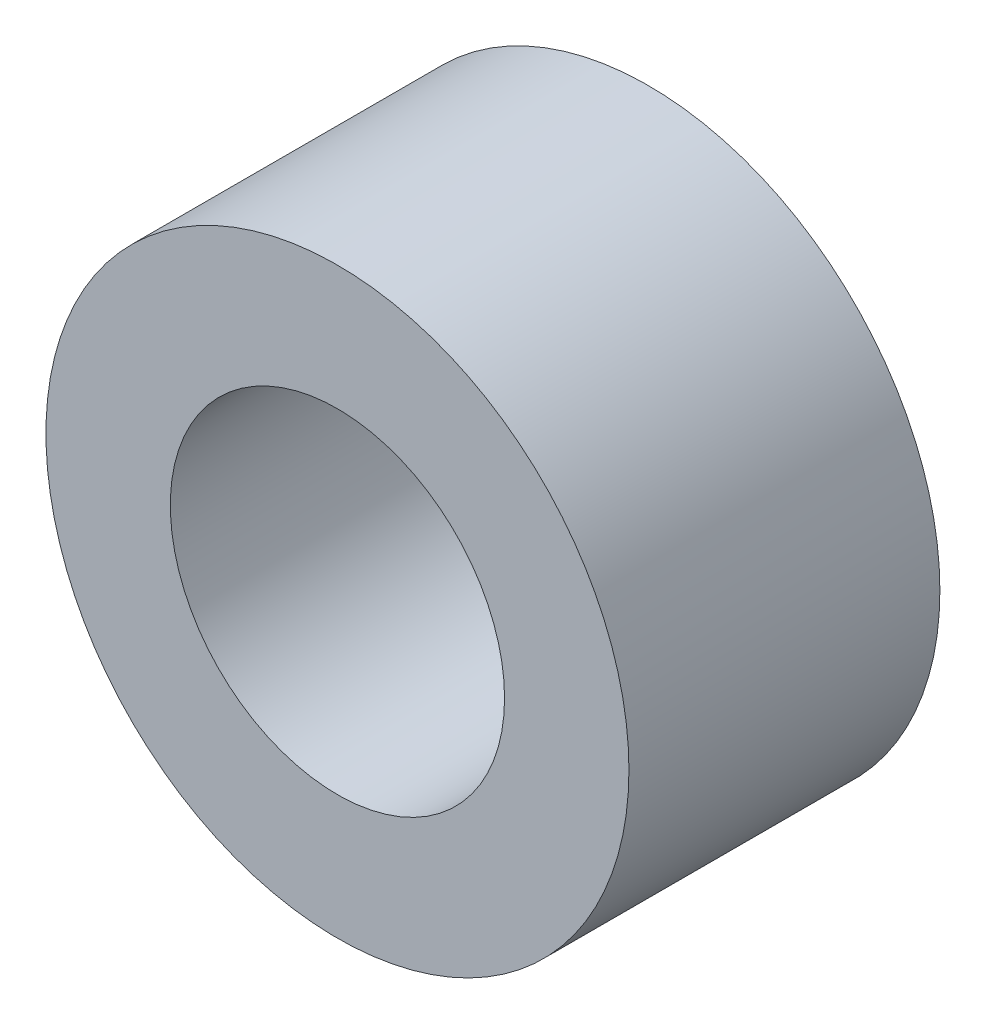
SolidWorks part; units mm, degrees
ref_plane "Front" through (0, 0, 0) normal (0, 0, 1) x (1, 0, 0)
ref_plane "Top" through (0, 0, 0) normal (0, 1, 0) x (1, 0, 0)
ref_plane "Right" through (0, 0, 0) normal (1, 0, 0) x (0, 0, -1)
sketch "Sketch1" plane through (0, 0, 0) normal (0, 0, 1) x (1, 0, 0)
  line L0 (108.2143, 14.6516) -> (8.0357, 36.6289)
  line L1 (108.2143, -14.6516) -> (8.0357, -36.6289)
  circle A0 centre (0, 0) radius 37.5
  circle A1 centre (105, 0) radius 15
  circle A2 centre (0, 0) radius 21.5
  circle A3 centre (105, 0) radius 8.5
  dimension "D1" = 75
  dimension "D2" = 43
  dimension "D3" = 30
  dimension "D4" = 17
  dimension "D5" = 105
extrude "Boss-Extrude1" add sketch "Sketch1" along normal mid plane 40 contours A0 A2
